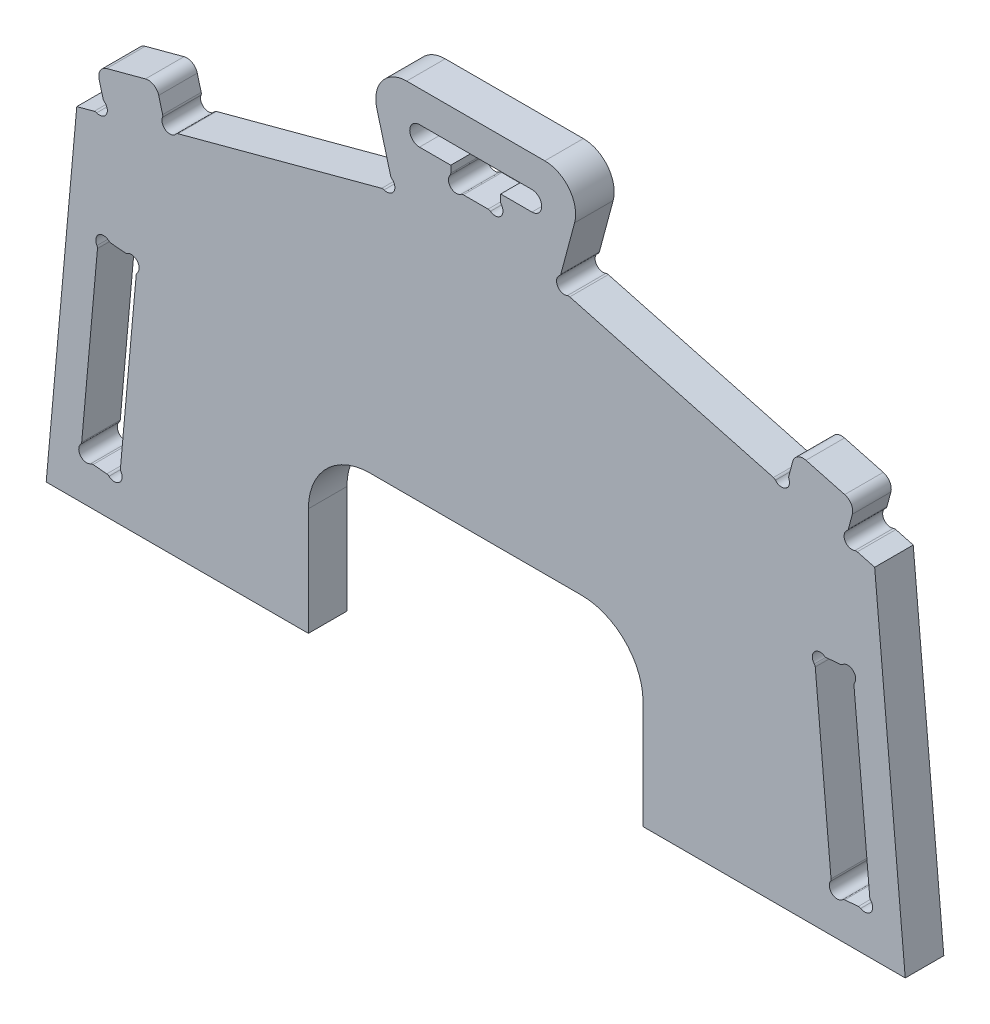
SolidWorks part; units mm, degrees
ref_plane "Front Plane" through (0, 0, 0) normal (0, 0, 1) x (1, 0, 0)
ref_plane "Top Plane" through (0, 0, 0) normal (0, 1, 0) x (1, 0, 0)
ref_plane "Right Plane" through (0, 0, 0) normal (1, 0, 0) x (0, 0, -1)
sketch "Sketch1" plane through (0, 0, 0) normal (0, 0, 1) x (1, 0, 0)
  line L0 (0, 0) -> (19.8314, 220.723)
  line L2 (170, 0) -> (0, 0)
  line L3 (71.1391, 260.3528) -> (32.5021, 250)
  line L4 (0, 0) -> (0, 250) construction
  line L5 (0, 250) -> (278.5, 250) construction
  line L6 (223.2918, 283.6579) -> (214.4051, 316.8236)
  line L7 (233.7236, 342) -> (278.5, 342)
  line L8 (278.5, 342) -> (278.5, 321.7254)
  line L9 (278.5, 110) -> (210, 110)
  line L10 (170, 70) -> (170, 0)
  line L11 (71.1391, 260.3528) -> (75.5051, 244.0586)
  line L12 (85.4636, 238.3091) -> (217.5423, 273.6995)
  line L13 (77.6096, 236.2046) -> (82.7096, 245.0381) construction
  line L14 (151.5029, 256.0043) -> (145.0325, 280.1524) construction
  line L15 (278.5, 321.7254) -> (242.04, 321.7254)
  line L16 (242.04, 321.7254) -> (242.04, 309.0754) construction
  line L17 (242.04, 309.0754) -> (262.3247, 309.0754)
  line L18 (262.3247, 309.0754) -> (262.3247, 304.6565)
  line L19 (270.4558, 296.5254) -> (278.5, 296.5254)
  line L20 (278.5, 296.5254) -> (278.5, 110)
  line L21 (262.3247, 296.5254) -> (265.931, 300.1317) construction
  line L23 (32.5021, 250) -> (36.8681, 233.7058)
  line L24 (31.1186, 223.7474) -> (19.8314, 220.723)
  line L25 (34.5558, 228.4019) -> (38.9726, 225.8519) construction
  line L26 (-10.9646, 238.3531) -> (252.9747, 309.0754) construction
  line L28 (0, 0) -> (0, 556.5) construction
  line L29 (0, 556.5) -> (50, 556.5) construction
  line L34 (50, 556.5) -> (0, 0) construction
  line L35 (0, 0) -> (557, 0) construction
  line L36 (235.9306, 313.7634) -> (237.7513, 306.9684) construction
  line L43 (252.9747, 309.0754) -> (259.4451, 284.9273) construction
  line L44 (261.0047, 298.8117) -> (258.2546, 309.0754) construction
  arc A0 (75.4157, 242.4937) -> (84.1531, 237.4492) centre (80.1596, 240.6213) ccw
  arc A1 (84.1531, 237.4492) -> (85.4636, 238.3091) centre (86.1106, 235.8943) cw
  arc A2 (75.4157, 242.4937) -> (75.5051, 244.0586) centre (73.0903, 243.4116) ccw
  arc A3 (219.1072, 273.6101) -> (217.5423, 273.6995) centre (218.1893, 271.2846) ccw
  arc A4 (224.1516, 282.3474) -> (219.1072, 273.6101) centre (220.9795, 278.3539) cw
  arc A5 (224.1516, 282.3474) -> (223.2918, 283.6579) centre (225.7066, 284.305) cw
  arc A6 (214.4051, 316.8236) -> (233.7236, 342) centre (233.7236, 322) cw
  arc A7 (37.728, 232.3953) -> (32.6835, 223.658) centre (34.5558, 228.4019) cw
  arc A8 (242.04, 321.7254) -> (242.04, 309.0754) centre (242.04, 315.4004) ccw
  arc A9 (261.8333, 303.1681) -> (268.9673, 296.0341) centre (265.931, 300.1317) ccw
  arc A10 (268.9673, 296.0341) -> (270.4558, 296.5254) centre (270.4558, 294.0254) cw
  arc A11 (261.8333, 303.1681) -> (262.3247, 304.6565) centre (259.8247, 304.6565) ccw
  arc A12 (32.6835, 223.658) -> (31.1186, 223.7474) centre (31.7656, 221.3326) ccw
  arc A13 (36.8681, 233.7058) -> (37.728, 232.3953) centre (39.2829, 234.3529) ccw
  arc A14 (210, 110) -> (170, 70) centre (210, 70) ccw
  point P52 (278.5, 0)
extrude "Boss-Extrude1" add sketch "Sketch1" along normal blind 25 contours L23 A13 A7 A12 L24 L0 L2 L10 A14 L9 L20 L19 A10 A9 A11 L18 L17 A8 L15 L8 L7 A6 L6 A5 A4 A3 L12 A1 A0 A2 L11 L3
sketch "Sketch2" plane through (0, 0, 0) normal (0, 0, 1) x (1, 0, 0)
  line L0 (32.6309, 0) -> (34.8434, 24.6253) construction
  line L1 (170, 0) -> (0, 0) construction
  line L3 (170, 0) -> (0, 0) construction
  line L4 (58.3522, 145.4754) -> (48.1205, 31.5962)
  line L5 (28.1375, 90.7909) -> (53.2364, 88.5358) construction
  line L6 (33.2533, 147.7305) -> (23.0216, 33.8513)
  line L7 (30.3924, 25.0252) -> (39.2945, 24.2254)
  line L8 (42.0794, 155.1013) -> (50.9814, 154.3014)
  line L9 (22.294, 25.7528) -> (35.971, 37.1748) construction
  line L10 (34.0806, 155.8199) -> (22.3936, 25.7439) construction
  line L11 (0, 0) -> (19.8314, 220.723) construction
  line L12 (34.0806, 155.8199) -> (40.4073, 226.2363) construction
  line L13 (0, 0) -> (19.8314, 220.723) construction
  line L14 (85.4636, 238.3091) -> (217.5423, 273.6995) construction
  line L16 (33.972, 155.7293) -> (59.0709, 153.4742) construction
  arc A0 (22.399, 32.4128) -> (28.866, 24.669) centre (26.2085, 29.0219) ccw
  arc A1 (22.399, 32.4128) -> (23.0216, 33.8513) centre (20.5316, 34.075) ccw
  arc A2 (28.866, 24.669) -> (30.3924, 25.0252) centre (30.1687, 22.5353) cw
  arc A3 (40.7329, 23.6028) -> (39.2945, 24.2254) centre (39.0707, 21.7354) ccw
  arc A5 (48.4767, 30.0698) -> (40.7329, 23.6028) centre (44.1238, 27.4123) cw
  arc A7 (48.4767, 30.0698) -> (48.1205, 31.5962) centre (50.6105, 31.3725) cw
  arc A8 (58.9748, 146.9139) -> (58.3522, 145.4754) centre (60.8422, 145.2517) ccw
  arc A9 (58.9748, 146.9139) -> (52.5079, 154.6576) centre (55.1654, 150.3047) ccw
  arc A10 (52.5079, 154.6576) -> (50.9814, 154.3014) centre (51.2052, 156.7914) cw
  arc A11 (40.6409, 155.7238) -> (42.0794, 155.1013) centre (42.3031, 157.5912) ccw
  arc A12 (32.8971, 149.2569) -> (40.6409, 155.7238) centre (37.25, 151.9144) cw
  arc A13 (32.8971, 149.2569) -> (33.2533, 147.7305) centre (30.7634, 147.9542) cw
  point P21 (34.8434, 24.6253)
extrude "Cut-Extrude1" cut sketch "Sketch2" along normal through all
fillet "Fillet1" radius 7 2 edges at (71.1391, 260.3528, 12.5) (32.5021, 250, 12.5)
mirror "Symétrie1" about plane through (278.5, 296.5254, 25) normal (1, 0, 0)
ref_plane "Plane1" through (278.5, 0, 0) normal (1, 0, 0) x (0, 0, -1)
equation "\"tool_diameter\"=10"
equation "\"hole_clearance\"=0.1"
equation "\"material_thickness\"=25"
equation "\"clearance\"=0.1"
equation "\"outer_slot\"=0.5"
equation "\"fillet\"=7"
equation "\"D1@Boss-Extrude1\"=\"material_thickness\""
equation "\"D7@Sketch2\"=\"tool_diameter\"/2+\"hole_clearance\""
equation "\"D4@Sketch2\"=\"material_thickness\"/10"
equation "\"D6@Sketch2\"=\"material_thickness\"/2+\"clearance\""
equation "\"string\"= 2 * \"tool_diameter\" / 2 * cos ( 45deg )"
equation "\"angle\"= IIF ( \"string\" < \"limit\" , 45 , ( 180 - 2 * arcsin ( \"ThicknessVStool_dia\" ) ) / 2 )"
equation "\"limit\"= \"material_thickness\" / 2 * 5 / 6"
equation "\"ThicknessVStool_dia\"= IIF ( \"limit\" / \"tool_diameter\" > 1 , 1 , \"limit\" / \"tool_diameter\" )"
equation "\"D3@Sketch2\"= \"angle\""
equation "\"D4@Sketch1\"=\"tool_diameter\"/2 + \"hole_clearance\""
equation "\"D5@Sketch1\"=\"material_thickness\"/10"
equation "\"D15@Sketch1\"=\"material_thickness\""
equation "\"D16@Sketch1\"=\"material_thickness\" + \"clearance\"*2"
equation "\"D20@Sketch1\"=\"tool_diameter\"/2 +\"hole_clearance\""
equation "\"D19@Sketch1\"=\"material_thickness\"/10"
equation "\"D21@Sketch1\"=\"material_thickness\"/2 +\"clearance\"*3/2"
equation "\"D1@Fillet1\"=\"fillet\""
equation "\"D5@Sketch2\"=40 +\"material_thickness\" +\"clearance\"*2"
equation "\"D8@Sketch2\"=\"clearance\""
equation "\"D27@Sketch1\"=\"clearance\"+5"
equation "\"D9@Sketch2\"=\"clearance\""
equation "\"D22@Sketch1\"=(2440 - 8*13 - \"tool_diameter\"*11)/4"
equation "\"D25@Sketch1\"=(1220 - 2*13 - \"tool_diameter\"*2 - 50)/2  - \"tool_diameter\"/2"
equation "\"D28@Sketch1\"=(\"D22@Sketch1\" - \"tool_diameter\")/2"
